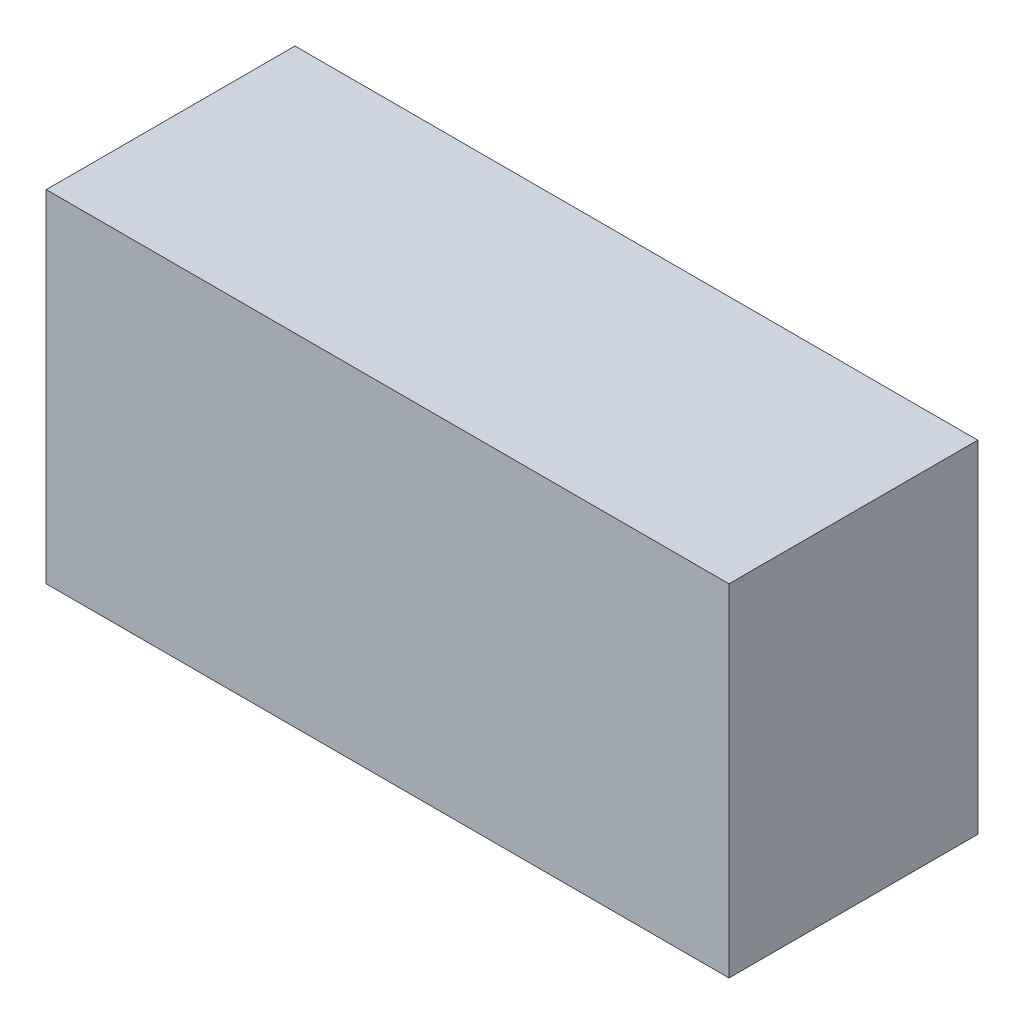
SolidWorks part; units mm, degrees
ref_plane "Front Plane" through (0, 0, 0) normal (0, 0, 1) x (1, 0, 0)
ref_plane "Top Plane" through (0, 0, 0) normal (0, 1, 0) x (1, 0, 0)
ref_plane "Right Plane" through (0, 0, 0) normal (1, 0, 0) x (0, 0, -1)
sketch "Sketch1" plane through (0, 0, 0) normal (0, 0, 1) x (1, 0, 0)
  line L1 (0, 0) -> (6096, 0)
  line L2 (0, 0) -> (0, 3048)
  line L3 (0, 3048) -> (6096, 3048)
  line L4 (6096, 0) -> (6096, 3048)
  dimension "D1" = 6096
  dimension "D2" = 3048
extrude "Boss-Extrude1" add sketch "Sketch1" along normal blind 2220.976
sketch "Sketch2" plane through (0, 3048, 0) normal (0, 1, 0) x (1, 0, 0)
  line L0 (6096, -2220.976) -> (0, 0) construction
  point P4 (3048, -1110.488)
sketch "Sketch3" plane through (6096, 0, 0) normal (1, 0, 0) x (0, -1, 0)
  line L0 (0, -2220.976) -> (-3048, 0) construction
  point P4 (-1524, -1110.488)
sketch "Sketch4" plane through (0, 0, 2220.976) normal (0, 0, 1) x (1, 0, 0)
  line L0 (0, 0) -> (3048, 3048) construction
  line L1 (6096, 3048) -> (0, 3048) construction
  line L2 (0, 0) -> (6096, 0) construction
  point P4 (1524, 1524)
  dimension "D1" = 45
shell "Shell1" thickness 304.8
